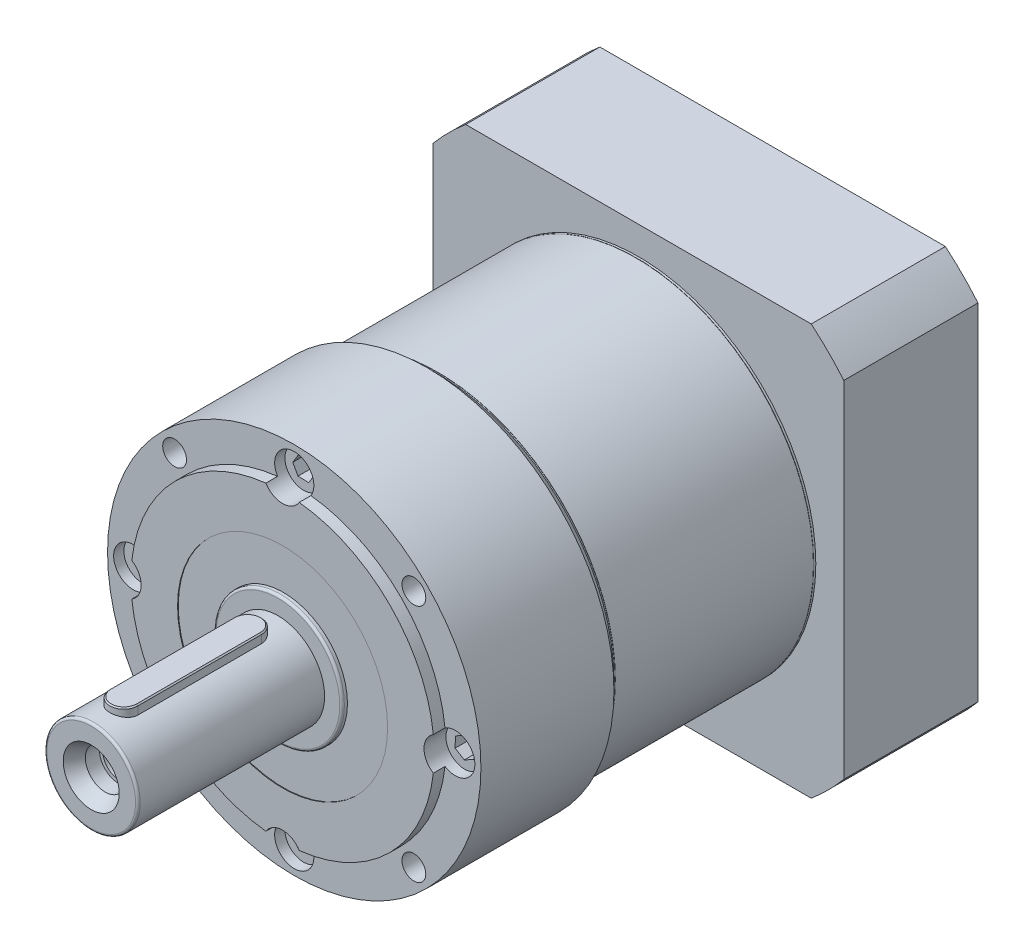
SolidWorks part; units mm, degrees
ref_plane "前视基准面" through (0, 0, 0) normal (0, 0, 1) x (1, 0, 0)
ref_plane "上视基准面" through (0, 0, 0) normal (0, 1, 0) x (1, 0, 0)
ref_plane "右视基准面" through (0, 0, 0) normal (1, 0, 0) x (0, 0, -1)
sketch "草图1" plane through (0, 0, 0) normal (0, 0, 1) x (1, 0, 0)
  circle A0 centre (0, 0) radius 80
extrude "凸台-拉伸1" add sketch "草图1" along normal blind 61.5
sketch "草图2" plane through (0, 0, 61.5) normal (0, 0, 1) x (1, 0, 0)
  circle A0 centre (0, 0) radius 65
extrude "凸台-拉伸2" add sketch "草图2" along normal blind 5
sketch "草图3" plane through (0, 0, 0) normal (0, 0, -1) x (-1, 0, 0)
  circle A0 centre (0, 0) radius 76
extrude "切除-拉伸1" cut sketch "草图3" against normal blind 0.5 flip side to cut
chamfer "倒角1" distance 4 angle 45 1 edges at (-80, 0, 0.5)
sketch "草图4" plane through (0, 0, 66.5) normal (0, 0, 1) x (1, 0, 0)
  line L0 (0, 0) -> (0, -69) construction
  circle A0 centre (0, 0) radius 69 construction
  circle A1 centre (0, -69) radius 8.4
extrude "切除-拉伸2" cut sketch "草图4" against normal blind 19
pattern_circular "阵列(圆周)1" count 4 over 360 about axis through (0, 0, 0) along (0, 0, 1) of "切除-拉伸2"
sketch "草图5" plane through (0, 0, 66.5) normal (0, 0, 1) x (1, 0, 0)
  circle A0 centre (0, 0) radius 27.5
extrude "凸台-拉伸3" add sketch "草图5" along normal blind 2
sketch "草图6" plane through (0, 0, 68.5) normal (0, 0, 1) x (1, 0, 0)
  circle A0 centre (0, 0) radius 20
extrude "凸台-拉伸4" add sketch "草图6" along normal blind 80
fillet "圆角1" radius 1 1 edges at (20, 0, 148.5)
fillet "圆角2" radius 1 1 edges at (27.5, 0, 68.5)
sketch "草图7" plane through (0, 0, 66.5) normal (0, 0, 1) x (1, 0, 0)
  circle A0 centre (0, 0) radius 45
  circle A1 centre (0, 0) radius 27.5
extrude "切除-拉伸3" cut sketch "草图7" against normal blind 0.3
ref_plane "基准面1" through (0, 0, -0.1) normal (0, 0, -1) x (-1, 0, 0)
sketch "草图8" plane through (0, 0, 61.5) normal (0, 0, 1) x (1, 0, 0)
  line L0 (0, 0) -> (0, 72.5)
  line L1 (0, 0) -> (-51.2652, 51.2652)
  circle A0 centre (0, 0) radius 72.5
  dimension "D1" = 45
hole_wizard "M12 螺纹孔1" positions "3D草图1" profile "草图9" tap size "M12" standard "GB"
sketch3d "3D草图1"
  point P0 (-51.2652, 51.2652, 61.5)
sketch "草图9" plane through (-51.2652, 51.2652, 61.5) normal (1, 0, 0) x (0, -1, 0)
  line L0 (0, 0) -> (0, 30.0644)
  line L1 (0, 30.0644) -> (5.1, 27)
  line L2 (5.1, 27) -> (5.1, 0)
  line L5 (5.1, 0) -> (0, 0)
  line L10 (0, 30.0644) -> (-5.1, 27) construction
  line L11 (0, -6.35) -> (0, 107.95) construction
  dimension "螺纹孔钻头直径" = 10.2
  dimension "螺纹孔钻头深度" = 27
  dimension "导头角度" = 118
pattern_circular "阵列(圆周)2" count 4 over 360 about axis through (0, 0, 0) along (0, 0, 1) of "M12 螺纹孔1"
sketch "草图10" plane through (0, 0, -0.1) normal (0, 0, -1) x (-1, 0, 0)
  circle A0 centre (0, 0) radius 76
extrude "凸台-拉伸5" add sketch "草图10" along normal blind 84.9 separate body
ref_plane "基准面2" through (0, 0, -85.1) normal (0, 0, -1) x (-1, 0, 0)
sketch "草图11" plane through (0, 0, -85.1) normal (0, 0, -1) x (-1, 0, 0)
  circle A0 centre (0, 0) radius 76
extrude "凸台-拉伸6" add sketch "草图11" along normal blind 0.9 separate body
sketch "草图12" plane through (0, 0, -86) normal (0, 0, -1) x (-1, 0, 0)
  line L1 (-74.0338, 88) -> (74.0338, 88)
  line L2 (-88, 74.0338) -> (-88, -74.0338)
  line L3 (-74.0338, -88) -> (74.0338, -88)
  line L4 (88, 74.0338) -> (88, -74.0338)
  arc A0 (-74.0338, 88) -> (-88, 74.0338) centre (0, 0) ccw
  arc A1 (-88, -74.0338) -> (-74.0338, -88) centre (0, 0) ccw
  arc A2 (74.0338, -88) -> (88, -74.0338) centre (0, 0) ccw
  arc A3 (88, 74.0338) -> (74.0338, 88) centre (0, 0) ccw
  dimension "D1" = 88
  dimension "D3" = 88
extrude "凸台-拉伸7" add sketch "草图12" along normal blind 57.5
sketch "草图13" plane through (0, 0, -143.5) normal (0, 0, -1) x (-1, 0, 0)
  circle A0 centre (0, 0) radius 57.15
extrude "切除-拉伸4" cut sketch "草图13" against normal blind 7
sketch "草图14" plane through (0, 0, -136.5) normal (0, 0, -1) x (-1, 0, 0)
  circle A0 centre (0, 0) radius 55
extrude "切除-拉伸5" cut sketch "草图14" against normal blind 25
sketch "草图15" plane through (0, 0, -111.5) normal (0, 0, -1) x (-1, 0, 0)
  circle A0 centre (0, 0) radius 50
extrude "切除-拉伸6" cut sketch "草图15" against normal blind 30.5
sketch "草图16" plane through (0, 0, -143.5) normal (0, 0, -1) x (-1, 0, 0)
  line L0 (0, 0) -> (0, -67.5) construction
  circle A0 centre (0, 0) radius 67.5 construction
  circle A1 centre (0, -67.5) radius 7
extrude "切除-拉伸7" cut sketch "草图16" against normal blind 11
pattern_circular "阵列(圆周)3" count 4 over 360 about axis through (0, 0, 0) along (0, 0, 1) of "切除-拉伸7"
sketch "草图17" plane through (0, 0, -143.5) normal (0, 0, -1) x (-1, 0, 0)
  line L0 (0, 0) -> (-81.3173, 81.3173)
  circle A0 centre (0, 0) radius 100
  arc A1 (-74.0338, 88) -> (-88, 74.0338) centre (0, 0) ccw construction
hole_wizard "M8 螺纹孔1" positions "3D草图2" profile "草图18" tap size "M8" standard "GB"
sketch3d "3D草图2"
  line L0 (0, 0, -143.5) -> (81.3173, 81.3173, -143.5) construction
  circle A0 centre (0, 0, -143.5) radius 100 construction
  point P0 (70.7107, 70.7107, -143.5)
  point P6 (0, 0, -243.5)
sketch "草图18" plane through (70.7107, 70.7107, -143.5) normal (1, 0, 0) x (0, 1, 0)
  line L0 (0, 0) -> (0, 31.0429)
  line L1 (0, 31.0429) -> (3.4, 29)
  line L2 (3.4, 29) -> (3.4, 0)
  line L5 (3.4, 0) -> (0, 0)
  line L10 (0, 31.0429) -> (-3.4, 29) construction
  line L11 (0, -6.35) -> (0, 107.95) construction
  dimension "螺纹孔钻头直径" = 6.8
  dimension "螺纹孔钻头深度" = 29
  dimension "导头角度" = 118
pattern_circular "阵列(圆周)4" count 4 over 360 about axis through (0, 0, 0) along (0, 0, 1) of "M8 螺纹孔1"
sketch "草图19" plane through (0, 0, 47.5) normal (0, 0, 1) x (1, 0, 0)
  line L1 (2.4055, 72.943) -> (-2.212, 73.0547)
  line L2 (-2.212, 73.0547) -> (-4.6175, 69.1117)
  line L3 (-4.6175, 69.1117) -> (-2.4055, 65.057)
  line L4 (-2.4055, 65.057) -> (2.212, 64.9453)
  line L5 (2.212, 64.9453) -> (4.6175, 68.8883)
  line L6 (4.6175, 68.8883) -> (2.4055, 72.943)
  circle A0 centre (0, 69) radius 8
  circle A1 centre (0, 69) radius 4 construction
  dimension "D1" = 8
extrude "凸台-拉伸8" add sketch "草图19" along normal blind 10
pattern_circular "阵列(圆周)5" count 4 over 360 about axis through (0, 0, 0) along (0, 0, 1) of "凸台-拉伸8"
sketch "草图20" plane through (0, 0, -132.5) normal (0, 0, -1) x (-1, 0, 0)
  line L1 (1.7033, 70.5164) -> (-1.7607, 70.4833)
  line L2 (-1.7607, 70.4833) -> (-3.4639, 67.4669)
  line L3 (-3.4639, 67.4669) -> (-1.7033, 64.4836)
  line L4 (-1.7033, 64.4836) -> (1.7607, 64.5167)
  line L5 (1.7607, 64.5167) -> (3.4639, 67.5331)
  line L6 (3.4639, 67.5331) -> (1.7033, 70.5164)
  circle A0 centre (0, 67.5) radius 6.5
  circle A1 centre (0, 67.5) radius 3 construction
  dimension "D1" = 6
extrude "凸台-拉伸9" add sketch "草图20" along normal blind 8
pattern_circular "阵列(圆周)6" count 4 over 360 about axis through (0, 0, 0) along (0, 0, 1) of "凸台-拉伸9"
ref_plane "基准面3" through (0, 0, -110.5) normal (0, 0, -1) x (-1, 0, 0)
sketch "草图21" plane through (0, 0, -110.5) normal (0, 0, -1) x (-1, 0, 0)
  circle A0 centre (0, 0) radius 37.5
extrude "凸台-拉伸10" add sketch "草图21" against normal up to surface (29.5 mm away)
chamfer "倒角2" distance 1.5 angle 45 1 edges at (-37.5, 0, -110.5)
sketch "草图22" plane through (0, 0, -143.5) normal (0, 0, -1) x (-1, 0, 0)
  circle A0 centre (0, 0) radius 17.5
extrude "切除-拉伸8" cut sketch "草图22" against normal blind 86
sketch "草图23" plane through (0, 0, -110.5) normal (0, 0, -1) x (-1, 0, 0)
  line L1 (-43.0001, 0.5) -> (42.7283, 0.5)
  line L2 (-43.0001, 0.5) -> (-43.0001, -0.5)
  line L3 (-43.0001, -0.5) -> (42.7283, -0.5)
  line L4 (42.7283, 0.5) -> (42.7283, -0.5)
  dimension "D1" = 0.5
  dimension "D2" = 1
extrude "切除-拉伸9" cut sketch "草图23" against normal up to surface (29.5 mm away)
sketch "草图24" plane through (0, 0, 0) normal (0, 1, 0) x (1, 0, 0)
  line L0 (-6, -134.5) -> (-6, -81.5)
  line L1 (6, -134.5) -> (6, -81.5)
  line L2 (-19, -148.5) -> (19, -148.5) construction
  arc A0 (-6, -134.5) -> (6, -134.5) centre (0, -134.5) ccw
  arc A1 (6, -81.5) -> (-6, -81.5) centre (0, -81.5) ccw
  dimension "D1" = 14
  dimension "D2" = 53
extrude "凸台-拉伸11" add sketch "草图24" along normal blind 23
chamfer "倒角3" distance 0.5 angle 45 4 edges at (6, 23, 108) (0, 23, 75.5) (0, 23, 140.5) (-6, 23, 108)
sketch "草图25" plane through (0, 0, 148.5) normal (0, 0, 1) x (1, 0, 0)
  circle A0 centre (0, 0) radius 8.5
extrude "切除-拉伸10" cut sketch "草图25" against normal blind 12
sketch "草图26" plane through (0, 0, 148.5) normal (0, 0, 1) x (1, 0, 0)
  circle A0 centre (0, 0) radius 12
ref_plane "基准面4" through (0, 0, 142.5) normal (0, 0, 1) x (1, 0, 0)
sketch "草图27" plane through (0, 0, 142.5) normal (0, 0, 1) x (1, 0, 0)
  circle A0 centre (0, 0) radius 8.5 construction
  circle A1 centre (0, 0) radius 8.5
loft "切除-放样1" cut profiles "草图26", "草图27"
hole_wizard "M16 螺纹孔1" positions "3D草图3" profile "草图28" tap size "M16" standard "GB"
sketch3d "3D草图3"
  line L0 (0, 0, 136.5) -> (0, 0, 142.5) construction
  point P0 (0, 0, 136.5)
sketch "草图28" plane through (0, 0, 136.5) normal (1, 0, 0) x (0, -1, 0)
  line L0 (0, 0) -> (0, 34.206)
  line L1 (0, 34.206) -> (7, 30)
  line L2 (7, 30) -> (7, 0)
  line L5 (7, 0) -> (0, 0)
  line L10 (0, 34.206) -> (-7, 30) construction
  line L11 (0, -6.35) -> (0, 107.95) construction
  dimension "螺纹孔钻头直径" = 14
  dimension "螺纹孔钻头深度" = 30
  dimension "导头角度" = 118
